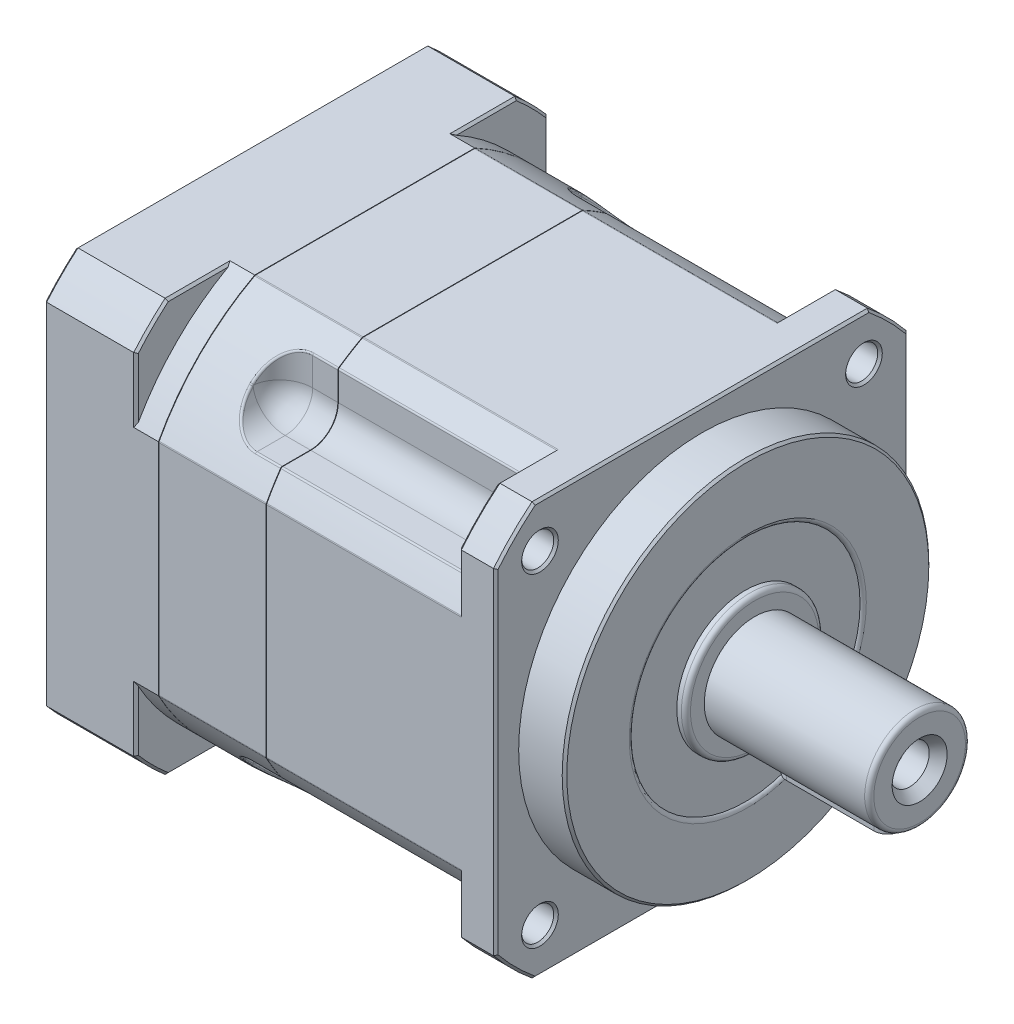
SolidWorks part; units mm, degrees
other "TeethCuts"
ref_plane "前视基准面" through (0, 0, 0) normal (0, 0, 1) x (1, 0, 0)
ref_plane "上视基准面" through (0, 0, 0) normal (0, 1, 0) x (1, 0, 0)
ref_plane "右视基准面" through (0, 0, 0) normal (1, 0, 0) x (0, 0, -1)
imported_body "输入1"
sketch "草图1" plane through (18.5, 0, 0) normal (1, 0, 0) x (0, 0, -1)
  line L1 (-45, 45) -> (45, 45)
  line L2 (-45, 45) -> (-45, -45)
  line L3 (-45, -45) -> (45, -45)
  line L4 (45, 45) -> (45, -45)
  circle A0 centre (0, 0) radius 40 construction
  circle A1 centre (0, 0) radius 40
  dimension "D1" = 45
  dimension "D2" = 90
  dimension "D3" = 45
  dimension "D4" = 90
extrude "凸台-拉伸1" add sketch "草图1" against normal up to surface (18.5 mm away)
sketch "草图2" plane through (0, 0, 0) normal (-1, 0, 0) x (0, 0, 1)
  line L0 (45, 45) -> (-45, 45) construction
  line L1 (45, -45) -> (45, 45) construction
  line L2 (-45, 45) -> (-45, -45) construction
  line L3 (-45, -45) -> (45, -45) construction
  line L4 (45, 45) -> (-45, 45)
  line L5 (45, -45) -> (45, 45)
  line L6 (-45, 45) -> (-45, -45)
  line L7 (-45, -45) -> (45, -45)
  circle A0 centre (0, 0) radius 37.5
extrude "凸台-拉伸2" add sketch "草图2" along normal blind 13.5
sketch "草图3" plane through (-13.5, 0, 0) normal (-1, 0, 0) x (0, 0, 1)
  line L0 (45, 45) -> (-45, 45) construction
  line L1 (45, -45) -> (45, 45) construction
  line L2 (-45, 45) -> (-45, -45) construction
  line L3 (-45, -45) -> (45, -45) construction
  line L4 (45, 45) -> (-45, 45)
  line L5 (45, -45) -> (45, 45)
  line L6 (-45, 45) -> (-45, -45)
  line L7 (-45, -45) -> (45, -45)
  circle A0 centre (0, 0) radius 40.3
extrude "凸台-拉伸3" add sketch "草图3" along normal blind 1.5
sketch "草图4" plane through (18.5, 0, 0) normal (1, 0, 0) x (0, 0, -1)
  line L0 (45, 45) -> (-45, 45) construction
  line L1 (45, -45) -> (45, 45) construction
  line L2 (-45, -45) -> (45, -45) construction
  line L3 (-45, 45) -> (-45, -45) construction
  line L4 (45, 45) -> (-45, 45)
  line L5 (45, -45) -> (45, 45)
  line L6 (-45, -45) -> (45, -45)
  line L7 (-45, 45) -> (-45, -45)
  circle A0 centre (0, 0) radius 36
extrude "凸台-拉伸4" add sketch "草图4" along normal blind 7
sketch "草图5" plane through (25.5, 0, 0) normal (1, 0, 0) x (0, 0, -1)
  line L0 (45, 45) -> (-45, 45) construction
  line L1 (45, -45) -> (45, 45) construction
  line L2 (-45, 45) -> (-45, -45) construction
  line L3 (-45, -45) -> (45, -45) construction
  line L4 (45, 45) -> (-45, 45)
  line L5 (45, -45) -> (45, 45)
  line L6 (-45, 45) -> (-45, -45)
  line L7 (-45, -45) -> (45, -45)
  circle A0 centre (0, 0) radius 27.5
extrude "凸台-拉伸5" add sketch "草图5" along normal blind 1.5
sketch "草图6" plane through (27, 0, 0) normal (1, 0, 0) x (0, 0, -1)
  circle A0 centre (0, 0) radius 51
extrude "切除-拉伸1" cut sketch "草图6" against normal up to surface (42 mm away) flip side to cut
sketch "草图7" plane through (27, 0, 0) normal (1, 0, 0) x (0, 0, -1)
  line L1 (-45, 45) -> (45, 45)
  line L2 (-45, 45) -> (-45, -45)
  line L3 (-45, -45) -> (45, -45)
  line L4 (45, 45) -> (45, -45)
  dimension "D1" = 45
  dimension "D2" = 90
  dimension "D3" = 45
  dimension "D4" = 90
extrude "凸台-拉伸6" add sketch "草图7" along normal blind 8
sketch "草图8" plane through (35, 0, 0) normal (1, 0, 0) x (0, 0, -1)
  circle A0 centre (0, 0) radius 40
extrude "凸台-拉伸7" add sketch "草图8" along normal blind 10
sketch "草图9" plane through (45, 0, 0) normal (1, 0, 0) x (0, 0, -1)
  circle A0 centre (0, 0) radius 25
extrude "切除-拉伸2" cut sketch "草图9" against normal blind 8
sketch "草图10" plane through (37, 0, 0) normal (1, 0, 0) x (0, 0, -1)
  circle A0 centre (0, 0) radius 27.5
extrude "切除-拉伸3" cut sketch "草图10" against normal up to next
sketch "草图11" plane through (-15, 0, 0) normal (-1, 0, 0) x (0, 0, 1)
  line L1 (-57.7226, 51.7404) -> (-29.35, 51.7404)
  line L2 (-57.7226, 51.7404) -> (-57.7226, 29.35)
  line L3 (-57.7226, 29.35) -> (-29.35, 29.35)
  line L4 (-29.35, 51.7404) -> (-29.35, 29.35)
  dimension "D1" = 29.35
  dimension "D2" = 29.35
extrude "切除-拉伸4" cut sketch "草图11" against normal up to surface (42 mm away)
pattern_circular "阵列(圆周)1" count 4 over 360 about axis through (0, 0, 0) along (1, 0, 0) of "切除-拉伸4"
fillet "圆角1" radius 6 4 edges at (6, -29.35, -29.35) (6, -29.35, 29.35) (6, 29.35, 29.35) (6, 29.35, -29.35)
sketch "草图12" plane through (27, 0, 0) normal (-1, 0, 0) x (0, 0, 1)
  circle A0 centre (0, 0) radius 58
extrude "切除-拉伸5" cut sketch "草图12" against normal blind 8 flip side to cut
sketch "草图13" plane through (27, 0, 0) normal (-1, 0, 0) x (0, 0, 1)
  line L0 (0, 0) -> (-35.35, 35.35) construction
  circle A0 centre (0, 0) radius 50 construction
  circle A1 centre (-35.35, 35.35) radius 3.5
extrude "切除-拉伸6" cut sketch "草图13" against normal blind 8
pattern_circular "阵列(圆周)2" count 4 over 360 about axis through (0, 0, 0) along (1, 0, 0) of "切除-拉伸6"
sketch "草图14" plane through (-15, 0, 0) normal (-1, 0, 0) x (0, 0, 1)
  line L0 (0, 0) -> (0, -60.7339)
  line L1 (0, 0) -> (-22.5, -38.9711)
  circle A0 centre (0, 0) radius 45
  dimension "D1" = 30
chamfer "倒角1" distance 0.5 angle 45 1 edges at (45, 0, -40)
chamfer "倒角2" distance 0.5 angle 45 12 edges at (35, 35.35, -31.85) (35, 31.85, 35.35) (35, -35.35, 31.85) (35, -31.85, -35.35) (35, -41.0122, -41.0122) (35, -45, 0) (35, -41.0122, 41.0122) (35, 0, 45) (35, 41.0122, 41.0122) (35, 45, 0) (35, 41.0122, -41.0122) (35, 0, -45)
sketch "草图16" plane through (0, 0, 0) normal (0, 0, 1) x (1, 0, 0)
  line L0 (41, 25) -> (42, 25)
  line L1 (42, 25) -> (42, 25.5)
  line L2 (42, 25.5) -> (41, 25)
  line L3 (45, -39.5) -> (45, 39.5) construction
  line L4 (0, 0) -> (59.7939, 0) construction
  dimension "D1" = 0.5
  dimension "D2" = 3
  dimension "D3" = 1
  dimension "D4" = 25
revolve "切除-旋转1" cut sketch "草图16" angle 360 about L4
chamfer "倒角3" distance 0.5 angle 45 1 edges at (45, 0, -25)
sketch "草图17" plane through (-15, 0, 0) normal (-1, 0, 0) x (0, 0, 1)
  circle A0 centre (0, 0) radius 42.4014
extrude "凸台-拉伸8" add sketch "草图17" against normal up to surface (50 mm away)
sketch "草图18" plane through (45, 0, 0) normal (1, 0, 0) x (0, 0, -1)
  circle A0 centre (0, 0) radius 30.2794
extrude "凸台-拉伸9" add sketch "草图18" against normal up to surface (10 mm away)
sketch "草图19" plane through (45, 0, 0) normal (1, 0, 0) x (0, 0, -1)
  circle A0 centre (0, 0) radius 15
extrude "凸台-拉伸10" add sketch "草图19" along normal blind 1.5
fillet "圆角2" radius 1 1 edges at (46.5, 0, -15)
sketch "草图20" plane through (45, 0, 0) normal (1, 0, 0) x (0, 0, -1)
  circle A0 centre (0, 0) radius 25
  circle A1 centre (0, 0) radius 15
extrude "切除-拉伸7" cut sketch "草图20" against normal blind 0.5
fillet "圆角3" radius 1 1 edges at (45, 0, -25)
sketch "草图21" plane through (35, 0, 0) normal (1, 0, 0) x (0, 0, -1)
  circle A0 centre (0, 0) radius 11
extrude "凸台-拉伸11" add sketch "草图21" along normal blind 47.5
fillet "圆角4" radius 1 1 edges at (82.5, 0, -11)
ref_plane "基准面1" through (-15.1, 0, 0) normal (-1, 0, 0) x (0, 0, 1)
sketch "草图22" plane through (-15.1, 0, 0) normal (-1, 0, 0) x (0, 0, 1)
  line L1 (-24, 45) -> (24, 45)
  line L2 (-45, 24) -> (-45, -24)
  line L3 (-24, -45) -> (24, -45)
  line L4 (45, 24) -> (45, -24)
  arc A0 (-24, 45) -> (-45, 24) centre (0, 0) ccw
  arc A1 (-45, -24) -> (-24, -45) centre (0, 0) ccw
  arc A2 (24, -45) -> (45, -24) centre (0, 0) ccw
  arc A3 (45, 24) -> (24, 45) centre (0, 0) ccw
  dimension "D1" = 45
  dimension "D3" = 45
extrude "凸台-拉伸12" add sketch "草图22" along normal blind 23.4 separate body
sketch "草图23" plane through (-15.1, 0, 0) normal (1, 0, 0) x (0, 0, -1)
  line L0 (29.35, 35.35) -> (29.35, 41.7082) construction
  line L1 (41.7082, 29.35) -> (35.35, 29.35) construction
  line L2 (29.35, 35.35) -> (29.35, 41.7082)
  line L3 (41.7082, 29.35) -> (35.35, 29.35)
  arc A0 (29.35, 35.35) -> (35.35, 29.35) centre (35.35, 35.35) ccw construction
  arc A1 (45, 24) -> (24, 45) centre (0, 0) ccw construction
  arc A2 (29.35, 35.35) -> (35.35, 29.35) centre (35.35, 35.35) ccw
  arc A3 (41.7082, 29.35) -> (29.35, 41.7082) centre (0, 0) ccw
extrude "切除-拉伸8" cut sketch "草图23" against normal blind 12
pattern_circular "阵列(圆周)3" count 4 over 360 about axis through (0, 0, 0) along (1, 0, 0) of "切除-拉伸8"
fillet "圆角5" radius 6.5 12 edges at (-27.1, 38.5291, -29.35) (-27.1, 29.35, -38.5291) (-27.1, -29.35, -38.5291) (-27.1, -31.1074, -31.1074) (-27.1, -38.5291, 29.35) (-27.1, -29.35, 38.5291) (-27.1, 38.5291, 29.35) (-27.1, 31.1074, 31.1074) (-27.1, 31.1074, -31.1074) (-27.1, -38.5291, -29.35) (-27.1, -31.1074, 31.1074) (-27.1, 29.35, 38.5291)
ref_plane "基准面2" through (-38.6, 0, 0) normal (-1, 0, 0) x (0, 0, 1)
sketch "草图24" plane through (-38.6, 0, 0) normal (-1, 0, 0) x (0, 0, 1)
  line L0 (24, 45) -> (-24, 45) construction
  line L1 (-45, 24) -> (-45, -24) construction
  line L2 (-24, -45) -> (24, -45) construction
  line L3 (45, -24) -> (45, 24) construction
  line L4 (24, 45) -> (-24, 45)
  line L5 (-45, 24) -> (-45, -24)
  line L6 (-24, -45) -> (24, -45)
  line L7 (45, -24) -> (45, 24)
  arc A0 (-24, 45) -> (-45, 24) centre (0, 0) ccw construction
  arc A1 (-45, -24) -> (-24, -45) centre (0, 0) ccw construction
  arc A2 (24, -45) -> (45, -24) centre (0, 0) ccw construction
  arc A3 (45, 24) -> (24, 45) centre (0, 0) ccw construction
  arc A4 (-24, 45) -> (-45, 24) centre (0, 0) ccw
  arc A5 (-45, -24) -> (-24, -45) centre (0, 0) ccw
  arc A6 (24, -45) -> (45, -24) centre (0, 0) ccw
  arc A7 (45, 24) -> (24, 45) centre (0, 0) ccw
extrude "凸台-拉伸13" add sketch "草图24" along normal blind 4.9 separate body
sketch "草图25" plane through (-43.5, 0, 0) normal (-1, 0, 0) x (0, 0, 1)
  line L1 (-38.1576, 45) -> (38.1576, 45)
  line L2 (-45, 38.1576) -> (-45, -38.1576)
  line L3 (-38.1576, -45) -> (38.1576, -45)
  line L4 (45, 38.1576) -> (45, -38.1576)
  arc A0 (-38.1576, 45) -> (-45, 38.1576) centre (0, 0) ccw
  arc A1 (-45, -38.1576) -> (-38.1576, -45) centre (0, 0) ccw
  arc A2 (38.1576, -45) -> (45, -38.1576) centre (0, 0) ccw
  arc A3 (45, 38.1576) -> (38.1576, 45) centre (0, 0) ccw
  dimension "D1" = 45
  dimension "D3" = 45
extrude "凸台-拉伸14" add sketch "草图25" along normal blind 20
sketch "草图26" plane through (-63.5, 0, 0) normal (-1, 0, 0) x (0, 0, 1)
  circle A0 centre (0, 0) radius 35
extrude "切除-拉伸9" cut sketch "草图26" against normal blind 7
sketch "草图29" plane through (-63.5, 0, 0) normal (-1, 0, 0) x (0, 0, 1)
  line L0 (0, 0) -> (0, -42.5) construction
  line L1 (0, 0) -> (21.25, -36.8061) construction
  circle A0 centre (0, 0) radius 42.5 construction
  circle A1 centre (21.25, -36.8061) radius 5.5
  dimension "D1" = 30
extrude "切除-拉伸10" cut sketch "草图29" against normal blind 17
pattern_circular "阵列(圆周)4" count 4 over 360 about axis through (0, 0, 0) along (1, 0, 0) of "切除-拉伸10"
sketch "草图30" plane through (-63.5, 0, 0) normal (-1, 0, 0) x (0, 0, 1)
  line L0 (0, 0) -> (0, -45) construction
  line L1 (0, 0) -> (31.8198, -31.8198)
  circle A0 centre (0, 0) radius 45 construction
  dimension "D1" = 45
hole_wizard "M5 螺纹孔1" positions "3D草图1" profile "草图31" tap size "M5" standard "GB"
sketch3d "3D草图1"
  point P0 (-63.5, -31.8198, 31.8198)
sketch "草图31" plane through (-63.5, -31.8198, 31.8198) normal (0, 1, 0) x (0, 0, 1)
  line L0 (0, 0) -> (0, 17.2618)
  line L1 (0, 17.2618) -> (2.1, 16)
  line L2 (2.1, 16) -> (2.1, 0)
  line L5 (2.1, 0) -> (0, 0)
  line L10 (0, 17.2618) -> (-2.1, 16) construction
  line L11 (0, -6.35) -> (0, 107.95) construction
  dimension "螺纹孔钻头直径" = 4.2
  dimension "螺纹孔钻头深度" = 16
  dimension "导头角度" = 118
pattern_circular "阵列(圆周)5" count 4 over 360 about axis through (0, 0, 0) along (1, 0, 0) of "M5 螺纹孔1"
sketch "草图32" plane through (-63.5, 0, 0) normal (-1, 0, 0) x (0, 0, 1)
  circle A0 centre (0, 0) radius 28
extrude "切除-拉伸11" cut sketch "草图32" against normal blind 19
ref_plane "基准面3" through (-55.5, 0, 0) normal (-1, 0, 0) x (0, 0, 1)
sketch "草图33" plane through (-55.5, 0, 0) normal (-1, 0, 0) x (0, 0, 1)
  circle A0 centre (0, 0) radius 23
extrude "凸台-拉伸15" add sketch "草图33" against normal up to surface (11 mm away)
chamfer "倒角4" distance 1 angle 45 1 edges at (-55.5, 0, 23)
sketch "草图34" plane through (-55.5, 0, 0) normal (-1, 0, 0) x (0, 0, 1)
  circle A0 centre (0, 0) radius 9.5
extrude "切除-拉伸12" cut sketch "草图34" against normal blind 36
sketch "草图35" plane through (-55.5, 0, 0) normal (-1, 0, 0) x (0, 0, 1)
  line L1 (-0.5, 24.7652) -> (0.5, 24.7652)
  line L2 (-0.5, 24.7652) -> (-0.5, -25.4851)
  line L3 (-0.5, -25.4851) -> (0.5, -25.4851)
  line L4 (0.5, 24.7652) -> (0.5, -25.4851)
  dimension "D1" = 0.5
  dimension "D2" = 1
extrude "切除-拉伸13" cut sketch "草图35" against normal up to surface (11 mm away)
sketch "草图36" plane through (-46.5, 0, 0) normal (-1, 0, 0) x (0, 0, 1)
  line L1 (-19.8643, 39.3385) -> (-22.7503, 39.2723)
  line L2 (-22.7503, 39.2723) -> (-24.136, 36.7399)
  line L3 (-24.136, 36.7399) -> (-22.6357, 34.2736)
  line L4 (-22.6357, 34.2736) -> (-19.7497, 34.3398)
  line L5 (-19.7497, 34.3398) -> (-18.364, 36.8723)
  line L6 (-18.364, 36.8723) -> (-19.8643, 39.3385)
  circle A0 centre (-21.25, 36.8061) radius 5
  circle A1 centre (-21.25, 36.8061) radius 2.5 construction
  dimension "D1" = 5
extrude "凸台-拉伸16" add sketch "草图36" along normal blind 10
pattern_circular "阵列(圆周)6" count 4 over 360 about axis through (0, 0, 0) along (1, 0, 0) of "凸台-拉伸16"
chamfer "倒角5" distance 0.5 angle 45 16 edges at (27, -41.0122, -41.0122) (27, -31.85, -35.35) (27, 41.0122, -41.0122) (27, 35.35, -31.85) (27, 31.85, 35.35) (27, 41.0122, 41.0122) (27, -35.35, 31.85) (27, -41.0122, 41.0122)
fillet "圆角6" radius 0.5 16 edges at (6, -41.7082, -29.35) (6, -29.35, -41.7082) (6, 29.35, -41.7082) (6, 41.7082, -29.35) (6, 41.7082, 29.35) (6, 29.35, 41.7082) (6, -29.35, 41.7082) (6, -41.7082, 29.35)
fillet "圆角7" radius 0.5 28 edges at (-17.85, -41.7082, 29.35) (-24.0781, -40.9797, 30.3589) (-27.1, -36.0624, 36.0624) (-17.85, -29.35, 41.7082) (-17.85, 29.35, 41.7082) (-24.0781, 30.3589, 40.9797) (-27.1, 36.0624, 36.0624) (-17.85, 41.7082, 29.35) (-17.85, 29.35, -41.7082) (-25.4719, 31.5471, -40.0722) (-27.1, 36.0624, -36.0624) (-24.0781, 40.9797, -30.3589) (-17.85, -41.7082, -29.35) (-25.4719, -40.0722, -31.5471) (-27.1, -36.0624, -36.0624) (-24.0781, -30.3589, -40.9797) (-26.8, -45, 24) (-25.4719, -31.5471, 40.0722) (-26.8, -24, 45) (-26.8, 24, 45) (-25.4719, 40.0722, 31.5471) (-26.8, 45, 24) (-26.8, 45, -24) (-26.8, 24, -45) (-26.8, -45, -24) (-26.8, -24, -45) (-17.85, 41.7082, -29.35) (-17.85, -29.35, -41.7082)
chamfer "倒角6" distance 0.5 angle 45 17 edges at (-63.5, 0, -45) (-63.5, 41.7193, -41.7193) (-63.5, 45, 0) (-63.5, 41.7193, 41.7193) (-63.5, 0, 45) (-63.5, -41.7193, 41.7193) (-63.5, -45, 0) (-63.5, -41.7193, -41.7193) (-63.5, 0, 35) (-63.5, -36.8061, 26.75) (-63.5, 26.75, 36.8061) (-63.5, 36.8061, -26.75) (-63.5, -26.75, -36.8061) (-63.5, -31.8198, 33.9198) (-63.5, 31.8198, 33.9198) (-63.5, 31.8198, -29.7198) (-63.5, -31.8198, -29.7198)
chamfer "倒角7" distance 0.5 angle 45 12 edges at (-43.5, -41.7193, -41.7193) (-43.5, 41.7193, -41.7193) (-43.5, 41.7193, 41.7193) (-43.5, -41.7193, 41.7193)
ref_plane "基准面4" through (0, -13.5, 0) normal (0, 1, 0) x (-1, 0, 0)
sketch "草图37" plane through (0, -13.5, 0) normal (0, 1, 0) x (-1, 0, 0)
  line L0 (-82.5, 10) -> (-82.5, -10) construction
  line L1 (-75.5, 3) -> (-56.5, 3)
  line L2 (-75.5, -3) -> (-56.5, -3)
  arc A0 (-75.5, 3) -> (-75.5, -3) centre (-75.5, 0) ccw
  arc A1 (-56.5, -3) -> (-56.5, 3) centre (-56.5, 0) ccw
  dimension "D1" = 7
  dimension "D2" = 19
extrude "凸台-拉伸17" add sketch "草图37" along normal blind 7
sketch "草图38" plane through (82.5, 0, 0) normal (1, 0, 0) x (0, 0, -1)
  circle A0 centre (0, 0) radius 4.25
extrude "切除-拉伸14" cut sketch "草图38" against normal blind 7.2
sketch "草图39" plane through (75.3, 0, 0) normal (1, 0, 0) x (0, 0, -1)
  circle A0 centre (0, 0) radius 2.2491
hole_wizard "M8 螺纹孔1" positions "3D草图2" profile "草图40" tap size "M8" standard "GB"
sketch3d "3D草图2"
  point P0 (75.3, 0, 0)
sketch "草图40" plane through (75.3, 0, 0) normal (0, 1, 0) x (0, 0, -1)
  line L0 (0, 0) -> (0, 21.7929)
  line L1 (0, 21.7929) -> (3.4, 19.75)
  line L2 (3.4, 19.75) -> (3.4, 0)
  line L5 (3.4, 0) -> (0, 0)
  line L10 (0, 21.7929) -> (-3.4, 19.75) construction
  line L11 (0, -6.35) -> (0, 107.95) construction
  dimension "螺纹孔钻头直径" = 6.8
  dimension "螺纹孔钻头深度" = 19.75
  dimension "导头角度" = 118
sketch "草图41" plane through (82.5, 0, 0) normal (1, 0, 0) x (0, 0, -1)
  circle A0 centre (0, 0) radius 6
ref_plane "基准面5" through (79.3, 0, 0) normal (1, 0, 0) x (0, 0, -1)
sketch "草图42" plane through (79.3, 0, 0) normal (1, 0, 0) x (0, 0, -1)
  circle A0 centre (0, 0) radius 3.4 construction
  circle A1 centre (0, 0) radius 3.4
loft "切除-放样1" cut profiles "草图41", "草图42"
